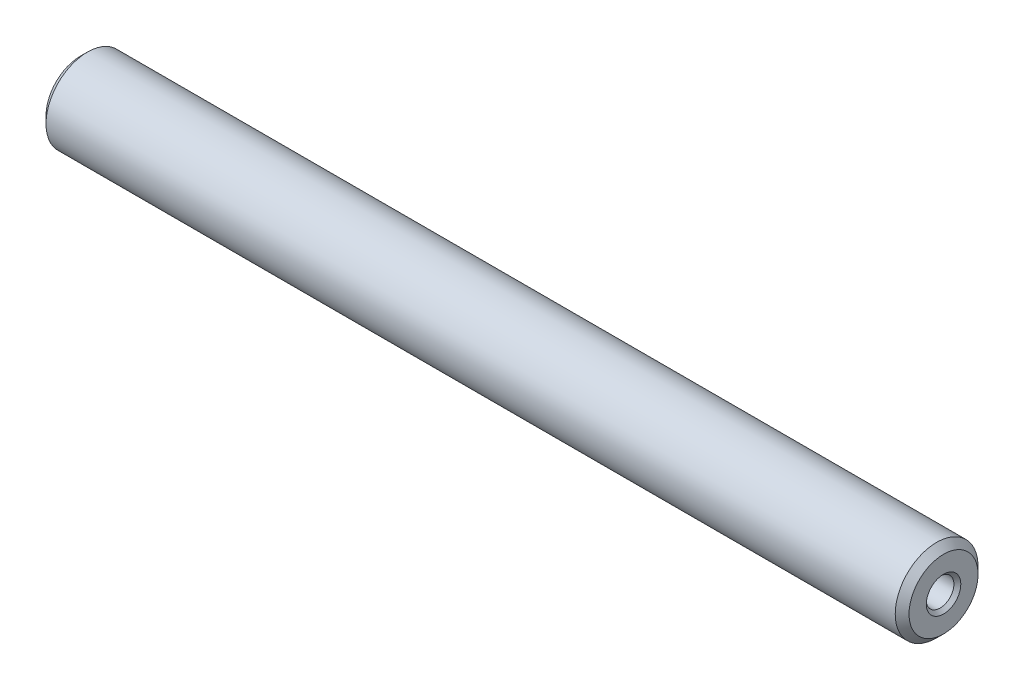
SolidWorks part; units mm, degrees
ref_plane "Plan de face" through (0, 0, 0) normal (0, 0, 1) x (1, 0, 0)
ref_plane "Plan de dessus" through (0, 0, 0) normal (0, 1, 0) x (1, 0, 0)
ref_plane "Plan de droite" through (0, 0, 0) normal (1, 0, 0) x (0, 0, -1)
sketch "Esquisse1" plane through (0, 0, 0) normal (0, 0, 1) x (1, 0, 0)
  line L0 (-35.683, 0) -> (42.8917, 0) construction
  line L1 (-62.5, 0) -> (-62.5, 6)
  line L2 (-62.5, 6) -> (62.5, 6)
  line L3 (62.5, 6) -> (62.5, 0)
  line L4 (-62.5, 0) -> (62.5, 0)
  dimension "D1" = 125
  dimension "D2" = 62.5
  dimension "D3" = 12
revolve "Révolution1" add sketch "Esquisse1" angle 360 about L0
chamfer "Chanfrein1" distance 1 angle 45 2 edges at (62.5, 0, 6) (-62.5, 0, 6)
hole_wizard "Diamètre du perçage Ø4.0 (4)1" positions "Esquisse3D1" profile "Esquisse2" hole size "Ø4.0" standard "Ansi Métrique"
sketch3d "Esquisse3D1"
  line L0 (61.5, 0, 0) -> (62.5, 0, 0) construction
  line L1 (-61.5, 0, 0) -> (-62.5, 0, 0) construction
  point P0 (62.5, 0, 0)
  point P4 (-62.5, 0, 0)
sketch "Esquisse2" plane through (62.5, 0, 0) normal (0, 1, 0) x (0, 0, -1)
  line L0 (0, 0) -> (0, 12.2017)
  line L1 (0, 12.2017) -> (2, 11)
  line L2 (2, 11) -> (2, 0.5)
  line L3 (2, 0.5) -> (2.5, 0)
  line L5 (2.5, 0) -> (0, 0)
  line L6 (-2, 0.5) -> (-2.5, 0) construction
  line L10 (0, 12.2017) -> (-2, 11) construction
  line L11 (0, -6.35) -> (0, 107.95) construction
  dimension "Diamètre du perçage" = 4
  dimension "Profondeur du perçage" = 11
  dimension "Diamètre du fraisage entrant" = 5
  dimension "Angle du fraisage entrant" = 90
  dimension "Angle de pointe" = 118
